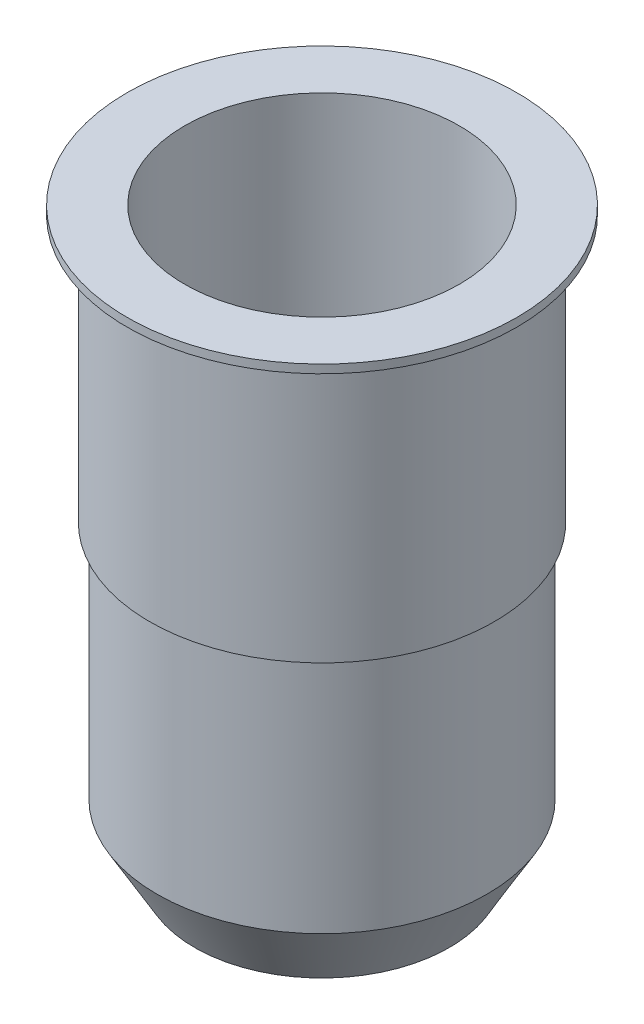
SolidWorks part; units mm, degrees
ref_plane "Plan1" through (0, 0, 0) normal (0, 0, 1) x (1, 0, 0)
ref_plane "Plan2" through (0, 0, 0) normal (0, 1, 0) x (1, 0, 0)
ref_plane "Plan3" through (0, 0, 0) normal (1, 0, 0) x (0, 0, -1)
sketch "Esquisse1" plane through (0, 0, 0) normal (0, 0, 1) x (1, 0, 0)
  line L0 (0, 6.3015) -> (0, -6.3015) construction
  line L1 (2.1, -11.6) -> (2.1, -6)
  line L2 (2.1, -6) -> (2.75, -6)
  line L3 (2.75, -6) -> (2.75, 0)
  line L4 (2.75, 0) -> (3.9, 0)
  line L5 (3.9, 0) -> (3.9, -0.4)
  line L6 (3.3, -11.6) -> (3.3, -5.5)
  line L7 (3.3, -11.6) -> (2.1, -11.6)
  line L8 (3.45, -0.4) -> (3.9, -0.4)
  line L9 (3.3, -5.5) -> (3.45, -5.5)
  line L10 (3.45, -5.5) -> (3.45, -0.4)
  dimension "D1" = 4.2
  dimension "D2" = 5.5
  dimension "D3" = 6
  dimension "D4" = 0.4
  dimension "D5" = 6.9
  dimension "D6" = 6.6
  dimension "D7" = 5.5
  dimension "D8" = 7.8
  dimension "D9" = 11.6
revolve "Base-Révolution" add sketch "Esquisse1" angle 360 about L0
chamfer "Chanfrein3" distance 0.75 angle 60
chamfer "Chanfrein6" distance 0.4 angle 30
